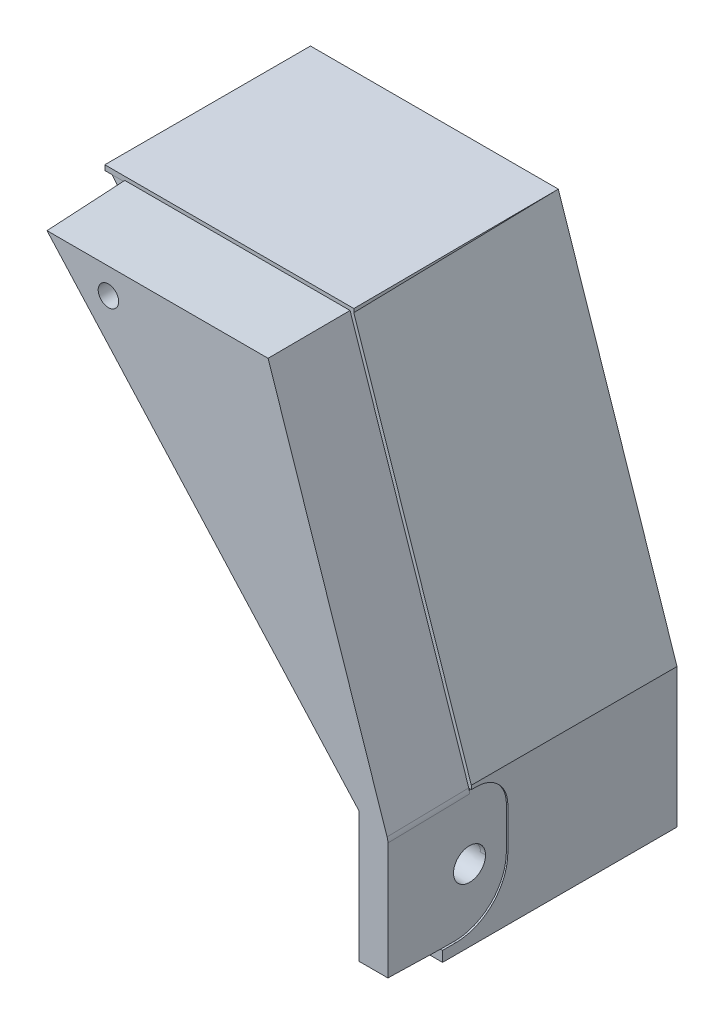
SolidWorks part; units mm, degrees
ref_plane "Plan de face" through (0, 0, 0) normal (0, 0, 1) x (1, 0, 0)
ref_plane "Plan de dessus" through (0, 0, 0) normal (0, 1, 0) x (1, 0, 0)
ref_plane "Plan de droite" through (0, 0, 0) normal (1, 0, 0) x (0, 0, -1)
imported_body "Importée1"
sketch "Esquisse1" plane through (0, 0, 0) normal (0, 0, 1) x (1, 0, 0)
  circle A0 centre (-29.5, -18) radius 3 construction
  circle A1 centre (-29.5, -18) radius 3
  circle A2 centre (-75, 33.9925) radius 3 construction
  circle A3 centre (-75, 33.9925) radius 3
  circle A4 centre (-75, 33.9925) radius 2
  dimension "D1" = 4
extrude "Extrusion1" add sketch "Esquisse1" against normal up to surface (56 mm away)
